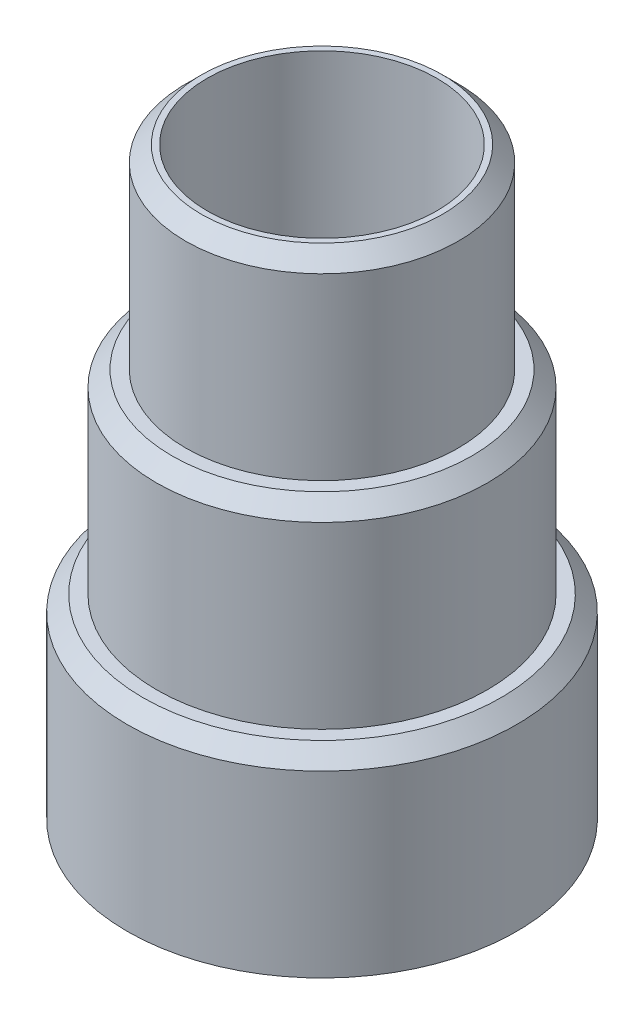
SolidWorks part; units mm, degrees
ref_plane "Front Plane" through (0, 0, 0) normal (0, 0, 1) x (1, 0, 0)
ref_plane "Top Plane" through (0, 0, 0) normal (0, 1, 0) x (1, 0, 0)
ref_plane "Right Plane" through (0, 0, 0) normal (1, 0, 0) x (0, 0, -1)
sketch "Sketch1" plane through (0, 0, 0) normal (0, 1, 0) x (1, 0, 0)
  circle A0 centre (0, 0) radius 10
  dimension "D1" = 20
extrude "Boss-Extrude1" add sketch "Sketch1" along normal blind 10
sketch "Sketch2" plane through (0, 10, 0) normal (0, 1, 0) x (1, 0, 0)
  circle A0 centre (0, 0) radius 8.5
  dimension "D1" = 17
extrude "Boss-Extrude2" add sketch "Sketch2" along normal blind 10
sketch "Sketch3" plane through (0, 20, 0) normal (0, 1, 0) x (1, 0, 0)
  circle A0 centre (0, 0) radius 7
  dimension "D1" = 14
extrude "Boss-Extrude3" add sketch "Sketch3" along normal blind 10
sketch "Sketch4" plane through (0, 30, 0) normal (0, 1, 0) x (1, 0, 0)
  circle A0 centre (0, 0) radius 5.9
  dimension "D1" = 11.8
extrude "Cut-Extrude1" cut sketch "Sketch4" against normal blind 14
hole_wizard "M4x0.7 Tapped Hole1" positions "Sketch6" profile "Sketch5" tap size "M4x0.7" standard "ANSI Metric"
sketch "Sketch6" plane through (0, 0, 0) normal (0, -1, 0) x (-1, 0, 0)
  point P0 (0, 0)
sketch "Sketch5" plane through (0, 0, 0) normal (1, 0, 0) x (0, 0, -1)
  line L0 (0, 0) -> (0, 11.0914)
  line L1 (0, 11.0914) -> (1.65, 10.1)
  line L2 (1.65, 10.1) -> (1.65, 0)
  line L5 (1.65, 0) -> (0, 0)
  line L10 (0, 11.0914) -> (-1.65, 10.1) construction
  line L11 (0, -6.35) -> (0, 107.95) construction
  dimension "Tap Drill Dia." = 3.3
  dimension "Tap Drill Depth" = 10.1
  dimension "Drill Angle" = 118
hole_wizard "M6x1.0 Tapped Hole1" positions "Sketch9" profile "Sketch8" tap size "M6x1.0" standard "ANSI Metric"
sketch "Sketch9" plane through (0, 16, 0) normal (0, 1, 0) x (1, 0, 0)
  point P0 (0, 0)
sketch "Sketch8" plane through (0, 16, 0) normal (1, 0, 0) x (0, 0, 1)
  line L0 (0, 0) -> (0, 10.5022)
  line L1 (0, 10.5022) -> (2.5, 9)
  line L2 (2.5, 9) -> (2.5, 0)
  line L5 (2.5, 0) -> (0, 0)
  line L10 (0, 10.5022) -> (-2.5, 9) construction
  line L11 (0, -6.35) -> (0, 107.95) construction
  dimension "Tap Drill Dia." = 5
  dimension "Tap Drill Depth" = 9
  dimension "Drill Angle" = 118
chamfer "Chamfer1" distance 0.8 angle 45 3 edges at (0, 30, 7) (0, 20, 8.5) (0, 10, 10)
